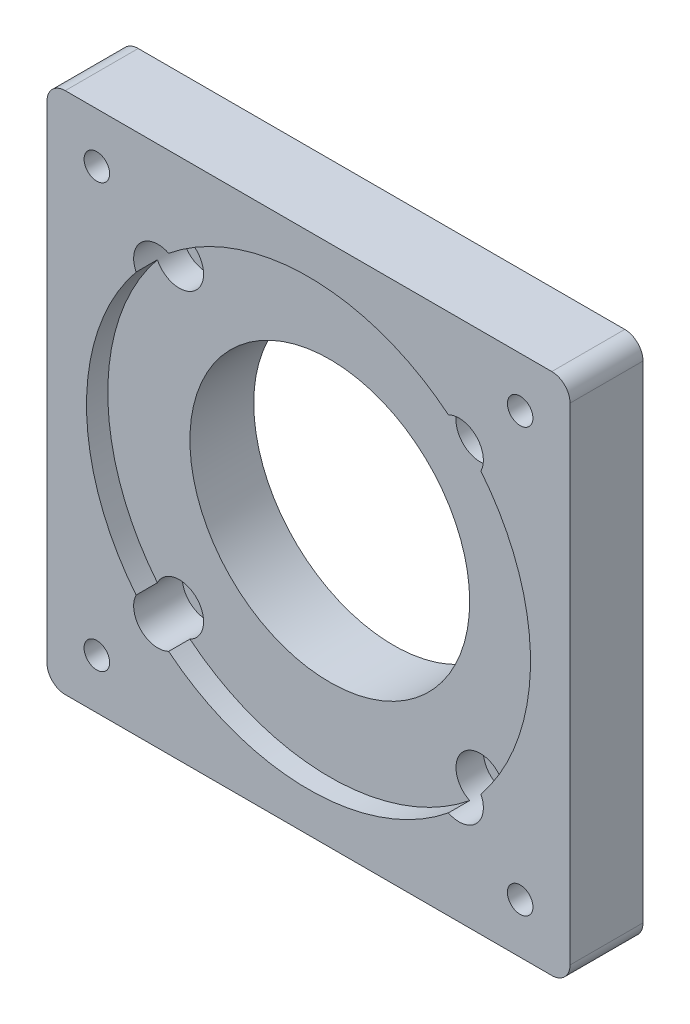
SolidWorks part; units mm, degrees
ref_plane "前视基准面" through (0, 0, 0) normal (0, 0, 1) x (1, 0, 0)
ref_plane "上视基准面" through (0, 0, 0) normal (0, 1, 0) x (1, 0, 0)
ref_plane "右视基准面" through (0, 0, 0) normal (1, 0, 0) x (0, 0, -1)
sketch "草图1" plane through (0, 0, 0) normal (0, 0, 1) x (1, 0, 0)
  line L1 (-40, 43) -> (40, 43)
  line L2 (-43, 40) -> (-43, -40)
  line L3 (-40, -43) -> (40, -43)
  line L4 (43, 40) -> (43, -40)
  line L5 (-43, 43) -> (43, -43) construction
  line L6 (-43, -43) -> (43, 43) construction
  arc A0 (40, -43) -> (43, -40) centre (40, -40) ccw
  arc A1 (-43, -40) -> (-40, -43) centre (-40, -40) ccw
  arc A2 (-40, 43) -> (-43, 40) centre (-40, 40) ccw
  arc A3 (40, 43) -> (43, 40) centre (40, 40) cw
  point P0 (0, 0)
  dimension "D1" = 3
  dimension "D2" = 86
extrude "凸台-拉伸1" add sketch "草图1" along normal blind 12
sketch "草图2" plane through (0, 0, 12) normal (0, 0, 1) x (1, 0, 0)
  circle A0 centre (0, 0) radius 23
  dimension "D1" = 46
extrude "切除-拉伸1" cut sketch "草图2" against normal through all
sketch "草图3" plane through (0, 0, 12) normal (0, 0, 1) x (1, 0, 0)
  circle A0 centre (0, 0) radius 36.5
  dimension "D1" = 73
extrude "切除-拉伸2" cut sketch "草图3" against normal blind 3.5
hole_wizard "打孔尺寸根据内六角圆柱头螺钉的类型1" positions "草图5" profile "草图4" counterbore size "M4" standard "Gb"
sketch "草图5" plane through (0, 0, 12) normal (0, 0, 1) x (1, 0, 0)
  point P0 (24.7487, 24.7487)
  point P5 (-24.7487, 24.7487)
  point P8 (-24.7487, -24.7487)
  point P11 (24.7487, -24.7487)
sketch "草图4" plane through (24.7487, 24.7487, 12) normal (1, 0, 0) x (0, -1, 0)
  line L0 (0, 0) -> (0, 12)
  line L1 (0, 12) -> (2.25, 12)
  line L3 (2.25, 12) -> (2.25, 8)
  line L4 (2.25, 8) -> (4, 8)
  line L5 (4, 8) -> (4, 0)
  line L7 (4, 0) -> (0, 0)
  line L11 (0, -6.35) -> (0, 107.95) construction
  dimension "Í¨¿×¿×Ö±¾¶" = 4.5
  dimension "Í¨¿×¿×Éî¶È" = 12
  dimension "ÖùÐÎ³ÁÍ·¿×Ö±¾¶" = 8
  dimension "ÖùÐÎ³ÁÍ·¿×Éî¶È" = 8
hole_wizard "M5 螺纹孔1" positions "草图7" profile "草图6" tap size "M5" standard "Gb"
sketch "草图7" plane through (0, 0, 12) normal (0, 0, 1) x (1, 0, 0)
  line L0 (0, 0) -> (-73.4102, 0) construction
  line L2 (0, 0) -> (0, -69.9316) construction
  point P0 (-34.8, 34.8)
  point P3 (34.8, 34.8)
  point P6 (-34.8, -34.8)
  point P9 (34.8, -34.8)
  dimension "D1" = 69.6
  dimension "D2" = 69.6
sketch "草图6" plane through (-34.8, 34.8, 12) normal (1, 0, 0) x (0, -1, 0)
  line L0 (0, 0) -> (0, 13.6618)
  line L1 (0, 13.6618) -> (2.1, 12.4)
  line L2 (2.1, 12.4) -> (2.1, 0)
  line L5 (2.1, 0) -> (0, 0)
  line L10 (0, 13.6618) -> (-2.1, 12.4) construction
  line L11 (0, -6.35) -> (0, 107.95) construction
  dimension "ÂÝÎÆ¿××êÍ·Ö±¾¶" = 4.2
  dimension "ÂÝÎÆ¿××êÍ·Éî¶È" = 12.4
  dimension "µ¼Í·½Ç¶È" = 118
sketch "草图8" plane through (0, 0, 0) normal (0, 0, -1) x (-1, 0, 0)
  circle A0 centre (0, 0) radius 25
  circle A1 centre (0, 0) radius 23
  circle A2 centre (0, 0) radius 23 construction
  dimension "D1" = 2
extrude "凸台-拉伸2" add sketch "草图8" along normal blind 2
